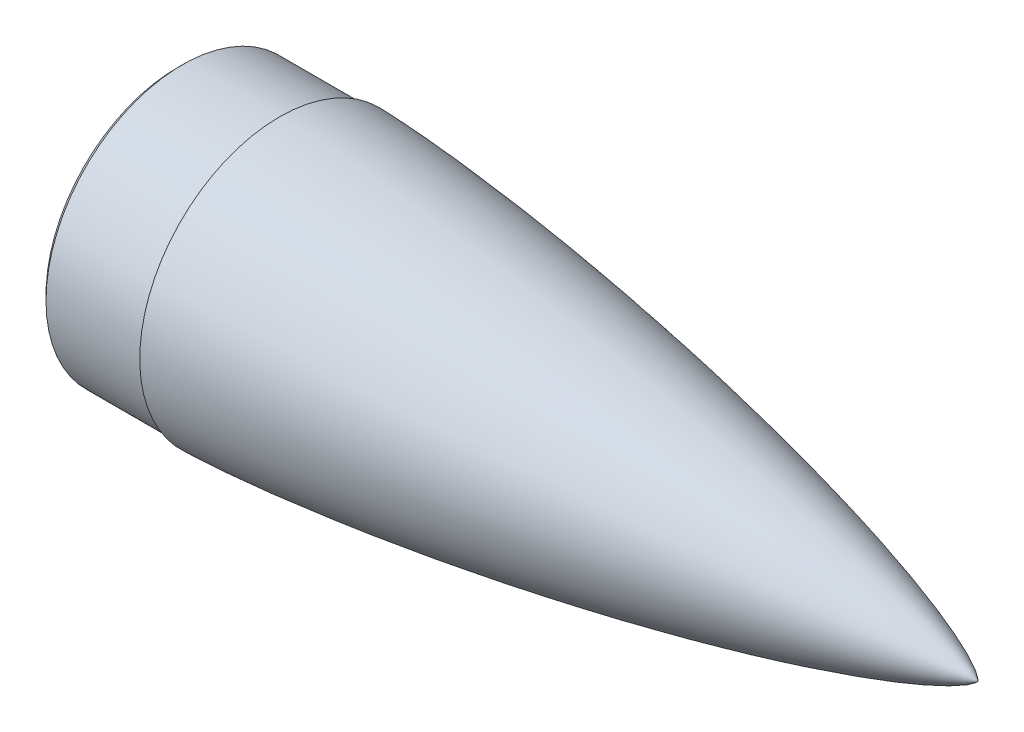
SolidWorks part; units mm, degrees
ref_plane "Front Plane" through (0, 0, 0) normal (0, 0, 1) x (1, 0, 0)
ref_plane "Top Plane" through (0, 0, 0) normal (0, 1, 0) x (1, 0, 0)
ref_plane "Right Plane" through (0, 0, 0) normal (1, 0, 0) x (0, 0, -1)
ref_axis "Axis1" through (46.9179, 0, 0) along (-1, 0, 0)
sketch "Sketch10" plane through (0, 0, 0) normal (0, 0, 1) x (1, 0, 0)
  line L1 (0, 0) -> (486.9547, 0) construction
  line L3 (10.4058, 74) -> (-59.6047, 74)
  line L4 (410, 0) -> (370, 0)
  line L5 (-59.6047, 74) -> (-59.6047, 80)
  line L6 (-59.6047, 80) -> (0.3953, 80)
  line L7 (0.3953, 80) -> (0.3953, 82)
  spline S0 degree 4 poles (410, 0) (409.9975, 0.0135) (409.9903, 0.0398) (409.9682, 0.0901) (409.9228, 0.1731) (409.8557, 0.2738) (409.7494, 0.4128) (409.5865, 0.6001) (409.3278, 0.8643) (408.8869, 1.2618) (408.1308, 1.8624) (406.8022, 2.787) (404.4432, 4.2196) (400.2789, 6.4135) (393.3959, 9.5567) (381.5182, 14.281) (364.4202, 20.1562) (342.9172, 26.6587) (318.0464, 33.3763) (292.4185, 39.6708) (266.6767, 45.4808) (240.8439, 50.8699) (214.9342, 55.8756) (188.9575, 60.5206) (166.1751, 64.2782) (146.6128, 67.2799) (130.2888, 69.6317) (117.2166, 71.4213) (104.1318, 73.1159) (92.6717, 74.5119) (82.841, 75.6429) (74.6436, 76.5394) (68.0826, 77.2279) (61.5186, 77.8863) (54.9514, 78.513) (48.3811, 79.1063) (41.8077, 79.6639) (36.0532, 80.118) (31.1188, 80.4808) (27.0054, 80.764) (23.7139, 80.9783) (20.0971, 81.1993) (16.7286, 81.3888) (13.6086, 81.5486) (10.7374, 81.6811) (8.44, 81.7772) (6.1421, 81.8626) (4.1311, 81.9251) (2.4071, 81.9694) (1.2575, 81.9897) (0.6827, 81.9986) (0.3953, 82) knots 0 0 0 0 0 0.00013 0.00026 0.00052 0.0009 0.00128 0.001925 0.002882 0.004418 0.006927 0.011111 0.018279 0.030673 0.051704 0.083102 0.139909 0.202703 0.265496 0.32829 0.391083 0.453877 0.516671 0.579464 0.642258 0.673655 0.705051 0.736448 0.767845 0.799242 0.81494 0.830639 0.846337 0.862036 0.877734 0.893432 0.909131 0.924829 0.932678 0.940527 0.948377 0.956226 0.967169 0.972641 0.978113 0.983585 0.989056 0.994528 0.997264 1 1 1 1 1 construction
  spline S1 degree 4 poles (410, 0) (409.9975, 0.0135) (409.9903, 0.0398) (409.9682, 0.0901) (409.9228, 0.1731) (409.8557, 0.2738) (409.7494, 0.4128) (409.5865, 0.6001) (409.3278, 0.8643) (408.8869, 1.2618) (408.1308, 1.8624) (406.8022, 2.787) (404.4432, 4.2196) (400.2789, 6.4135) (393.3959, 9.5567) (381.5182, 14.281) (364.4202, 20.1562) (342.9172, 26.6587) (318.0464, 33.3763) (292.4185, 39.6708) (266.6767, 45.4808) (240.8439, 50.8699) (214.9342, 55.8756) (188.9575, 60.5206) (166.1751, 64.2782) (146.6128, 67.2799) (130.2888, 69.6317) (117.2166, 71.4213) (104.1318, 73.1159) (92.6717, 74.5119) (82.841, 75.6429) (74.6436, 76.5394) (68.0826, 77.2279) (61.5186, 77.8863) (54.9514, 78.513) (48.3811, 79.1063) (41.8077, 79.6639) (36.0532, 80.118) (31.1188, 80.4808) (27.0054, 80.764) (23.7139, 80.9783) (20.0971, 81.1993) (16.7286, 81.3888) (13.6086, 81.5486) (10.7374, 81.6811) (8.44, 81.7772) (6.1421, 81.8626) (4.1311, 81.9251) (2.4071, 81.9694) (1.2575, 81.9897) (0.6827, 81.9986) (0.3953, 82) knots 0 0 0 0 0 0.00013 0.00026 0.00052 0.0009 0.00128 0.001925 0.002882 0.004418 0.006927 0.011111 0.018279 0.030673 0.051704 0.083102 0.139909 0.202703 0.265496 0.32829 0.391083 0.453877 0.516671 0.579464 0.642258 0.673655 0.705051 0.736448 0.767845 0.799242 0.81494 0.830639 0.846337 0.862036 0.877734 0.893432 0.909131 0.924829 0.932678 0.940527 0.948377 0.956226 0.967169 0.972641 0.978113 0.983585 0.989056 0.994528 0.997264 1 1 1 1 1
  spline S2 degree 4 poles (370, 0) (369.9978, 0.0123) (369.9914, 0.0363) (369.9715, 0.0823) (369.9315, 0.1572) (369.8727, 0.2475) (369.7801, 0.3717) (369.6373, 0.5404) (369.4081, 0.7806) (369.0157, 1.1432) (368.3393, 1.6932) (367.1515, 2.5387) (365.0385, 3.8504) (361.3262, 5.8488) (355.2375, 8.6913) (344.7807, 12.9486) (329.7681, 18.2359) (310.9061, 24.0869) (289.0819, 30.1369) (266.5871, 35.8091) (243.9875, 41.0473) (221.3041, 45.9078) (198.5497, 50.424) (175.7335, 54.6161) (155.7206, 58.0081) (138.5346, 60.7184) (124.1925, 62.8423) (112.7069, 64.4586) (101.2096, 65.9893) (91.1393, 67.2504) (82.5004, 68.2722) (75.2966, 69.0822) (69.5307, 69.7042) (63.7619, 70.2991) (57.9902, 70.8653) (52.2156, 71.4013) (46.4381, 71.905) (41.3803, 72.3151) (37.0431, 72.6426) (33.4275, 72.8982) (30.5343, 73.0916) (27.3781, 73.2895) (23.9588, 73.4866) (20.7691, 73.6507) (17.8093, 73.7829) (15.3421, 73.8772) (13.6147, 73.9329) (12.1338, 73.9723) (11.1464, 73.9906) (10.6527, 73.9986) (10.4058, 74) knots 0 0 0 0 0 0.000135 0.00027 0.00054 0.00092 0.001299 0.001947 0.002931 0.004512 0.007081 0.01138 0.018708 0.031424 0.052705 0.084103 0.14091 0.203703 0.266497 0.329291 0.392084 0.454878 0.517672 0.580465 0.643259 0.674656 0.706052 0.737449 0.768846 0.800243 0.815941 0.831639 0.847338 0.863036 0.878735 0.894433 0.910132 0.92583 0.933679 0.941528 0.949378 0.957227 0.96792 0.978613 0.98396 0.989307 0.994653 0.997327 1 1 1 1 1 construction
  spline S3 degree 4 poles (370, 0) (369.9978, 0.0123) (369.9914, 0.0363) (369.9715, 0.0823) (369.9315, 0.1572) (369.8727, 0.2475) (369.7801, 0.3717) (369.6373, 0.5404) (369.4081, 0.7806) (369.0157, 1.1432) (368.3393, 1.6932) (367.1515, 2.5387) (365.0385, 3.8504) (361.3262, 5.8488) (355.2375, 8.6913) (344.7807, 12.9486) (329.7681, 18.2359) (310.9061, 24.0869) (289.0819, 30.1369) (266.5871, 35.8091) (243.9875, 41.0473) (221.3041, 45.9078) (198.5497, 50.424) (175.7335, 54.6161) (155.7206, 58.0081) (138.5346, 60.7184) (124.1925, 62.8423) (112.7069, 64.4586) (101.2096, 65.9893) (91.1393, 67.2504) (82.5004, 68.2722) (75.2966, 69.0822) (69.5307, 69.7042) (63.7619, 70.2991) (57.9902, 70.8653) (52.2156, 71.4013) (46.4381, 71.905) (41.3803, 72.3151) (37.0431, 72.6426) (33.4275, 72.8982) (30.5343, 73.0916) (27.3781, 73.2895) (23.9588, 73.4866) (20.7691, 73.6507) (17.8093, 73.7829) (15.3421, 73.8772) (13.6147, 73.9329) (12.1338, 73.9723) (11.1464, 73.9906) (10.6527, 73.9986) (10.4058, 74) knots 0 0 0 0 0 0.000135 0.00027 0.00054 0.00092 0.001299 0.001947 0.002931 0.004512 0.007081 0.01138 0.018708 0.031424 0.052705 0.084103 0.14091 0.203703 0.266497 0.329291 0.392084 0.454878 0.517672 0.580465 0.643259 0.674656 0.706052 0.737449 0.768846 0.800243 0.815941 0.831639 0.847338 0.863036 0.878735 0.894433 0.910132 0.92583 0.933679 0.941528 0.949378 0.957227 0.96792 0.978613 0.98396 0.989307 0.994653 0.997327 1 1 1 1 1
  point P7 (486.9547, 2.0902)
  point P13 (0, 0)
  dimension "D1" = 82
  dimension "D2" = 74
  dimension "D3" = 410
  dimension "D4" = 80
  dimension "D5" = 370
  dimension "D6" = 60
revolve "Revolve1" add sketch "Sketch10" angle 360 about axis through (46.9179, 0, 0) along (-1, 0, 0)
chamfer "Chamfer1" distance 3 angle 45 1 edges at (-59.6047, 0, -80)
